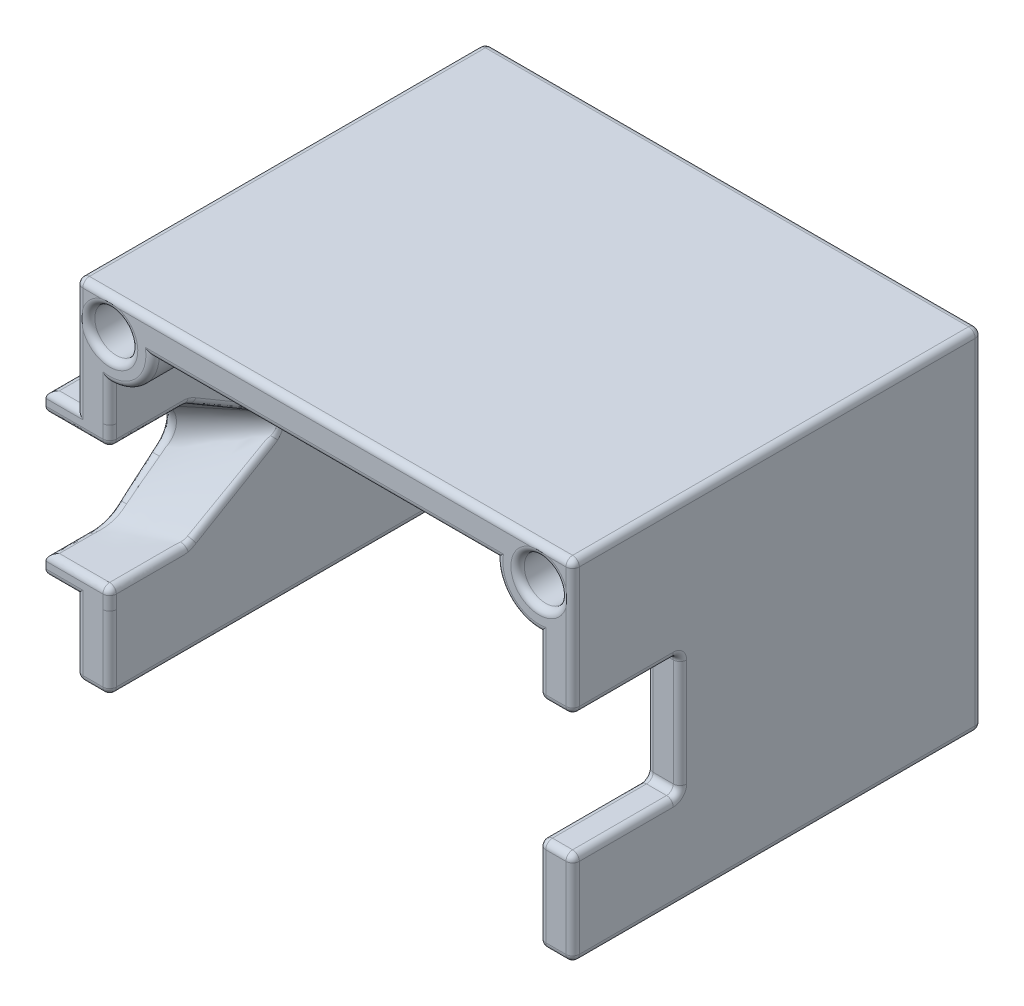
SolidWorks part; units mm, degrees
ref_plane "Front Plane" through (0, 0, 0) normal (0, 0, 1) x (1, 0, 0)
ref_plane "Top Plane" through (0, 0, 0) normal (0, 1, 0) x (1, 0, 0)
ref_plane "Right Plane" through (0, 0, 0) normal (1, 0, 0) x (0, 0, -1)
sketch "Sketch1" plane through (0, 0, 0) normal (0, 1, 0) x (1, 0, 0)
  line L1 (-14.6844, 12.1047) -> (14.6844, 12.1047)
  line L2 (-14.6844, 12.1047) -> (-14.6844, -12.1047)
  line L3 (-14.6844, -12.1047) -> (14.6844, -12.1047)
  line L4 (14.6844, 12.1047) -> (14.6844, -12.1047)
  line L5 (-14.6844, 12.1047) -> (14.6844, -12.1047) construction
  line L6 (-14.6844, -12.1047) -> (14.6844, 12.1047) construction
  point P0 (0, 0)
  dimension "D1" = 29.3687
  dimension "D2" = 24.2094
extrude "Boss-Extrude1" add sketch "Sketch1" along normal blind 20.6375
sketch "Sketch2" plane through (0, 0, 0) normal (0, -1, 0) x (1, 0, 0)
  line L0 (14.6844, 12.1047) -> (14.6844, -12.1047) construction
  line L2 (-8.9957, -10.1203) -> (12.7, -10.1203)
  line L3 (12.7, -10.1203) -> (12.7, 9.7234)
  line L4 (12.7, 9.7234) -> (-12.7, 9.7234)
  line L5 (-12.7, 9.7234) -> (-12.7, -10.1203)
  line L6 (-12.7, -10.1203) -> (-8.9957, -10.1203)
  line L7 (-14.6844, 12.1047) -> (14.6844, 12.1047) construction
  line L8 (14.6844, -12.1047) -> (-14.6844, -12.1047) construction
  line L9 (-14.6844, -12.1047) -> (-14.6844, 12.1047) construction
  dimension "D1" = 1.9844
  dimension "D2" = 2.3813
  dimension "D3" = 1.9844
  dimension "D4" = 1.9844
extrude "Cut-Extrude1" cut sketch "Sketch2" against normal offset from surface (18.6531 mm away) 1.9844
sketch "Sketch4" plane through (0, 0, 9.7234) normal (0, 0, -1) x (-1, 0, 0)
  line L0 (-12.7, 0) -> (-12.7, 18.6531)
  line L1 (-12.7, 18.6531) -> (12.7, 18.6531)
  line L2 (12.7, 18.6531) -> (12.7, 0)
  line L3 (12.7, 0) -> (-12.7, 0)
extrude "Cut-Extrude2" cut sketch "Sketch4" against normal through all
sketch "Sketch6" plane through (0, 0, 0) normal (0, -1, 0) x (1, 0, 0)
  line L0 (12.7, -10.1203) -> (12.7, 12.1047) construction
  line L1 (-12.7, -10.1203) -> (12.7, -10.1203) construction
  line L2 (12.7, -7.5803) -> (12.7, -10.1203)
  line L3 (12.7, -10.1203) -> (10.16, -10.1203)
  line L4 (0, -12.1047) -> (0, -10.1203) construction
  line L5 (14.6844, -12.1047) -> (-14.6844, -12.1047) construction
  arc A0 (12.7, -7.5803) -> (10.16, -10.1203) centre (12.7, -10.1203) ccw
  dimension "D1" = 2.54
ref_plane "Plane1" through (0, 0, 0) normal (1, 0, 0) x (0, 0, 1)
extrude "Boss-Extrude2" add sketch "Sketch6" against normal up to next
sketch "Sketch8" plane through (0, 0, 0) normal (0, -1, 0) x (1, 0, 0)
  line L0 (14.6844, -12.1047) -> (10.9039, -8.3243) construction
  arc A0 (12.7, -7.5803) -> (10.16, -10.1203) centre (12.7, -10.1203) ccw construction
  circle A1 centre (12.7, -10.1203) radius 1.27
  dimension "D2" = 2.54
extrude "Cut-Extrude3" cut sketch "Sketch8" against normal blind 2.032 contours A1
mirror "Mirror1" about plane through (0, 0, 0) normal (1, 0, 0) of "Cut-Extrude3", "Boss-Extrude2"
sketch "Sketch7" plane through (0, 0, 12.1047) normal (0, 0, 1) x (1, 0, 0)
  line L0 (12.7, 18.6531) -> (12.7, 0) construction
  line L1 (-12.7, 18.6531) -> (12.7, 18.6531) construction
  line L2 (10.16, 18.6531) -> (12.7, 18.6531)
  line L3 (12.7, 18.6531) -> (12.7, 16.1131)
  arc A0 (12.7, 16.1131) -> (10.16, 18.6531) centre (12.7, 18.6531) cw
  dimension "D1" = 2.54
extrude "Boss-Extrude3" add sketch "Sketch7" against normal up to surface (22.225 mm away)
sketch "Sketch9" plane through (0, 0, 12.1047) normal (0, 0, 1) x (1, 0, 0)
  line L0 (10.9039, 16.8571) -> (14.6844, 20.6375) construction
  arc A0 (10.16, 18.6531) -> (12.7, 16.1131) centre (12.7, 18.6531) ccw construction
  circle A1 centre (12.7, 18.6531) radius 1.27
  dimension "D2" = 2.54
extrude "Cut-Extrude4" cut sketch "Sketch9" against normal blind 2.032
mirror "Mirror2" about plane through (0, 0, 0) normal (1, 0, 0) of "Cut-Extrude4", "Boss-Extrude3"
sketch "Sketch10" plane through (-14.6844, 0, 0) normal (-1, 0, 0) x (0, 0, 1)
  line L1 (5.7547, 5.5556) -> (12.1047, 5.5556)
  line L2 (5.7547, 5.5556) -> (5.7547, 12.6994)
  line L3 (5.7547, 12.6994) -> (12.1047, 12.6994)
  line L4 (12.1047, 5.5556) -> (12.1047, 12.6994)
  line L5 (12.1047, 20.6375) -> (12.1047, 0) construction
  line L6 (-12.1047, 9.1275) -> (12.1047, 9.1275) construction
  line L7 (-12.1047, 20.6375) -> (-12.1047, 0) construction
  dimension "D1" = 3.5719
  dimension "D2" = 6.35
extrude "Cut-Extrude5" cut sketch "Sketch10" against normal through all
fillet "Fillet1" radius 0.3969 51 edges at (14.6844, 12.6994, 8.9297) (12.7, 12.6994, 8.9297) (14.6844, 16.6684, 12.1047) (13.6922, 12.6994, 12.1047) (12.7, 14.4062, 12.1047) (10.9039, 16.8571, 12.1047) (13.97, 18.6531, 12.1047) (0, 18.6531, 12.1047) (-13.97, 18.6531, 12.1047) (-10.9039, 16.8571, 12.1047) (-12.7, 14.4062, 12.1047) (-13.6922, 12.6994, 12.1047) (-12.7, 9.1275, 5.7547) (-13.6922, 12.6994, 5.7547) (13.6922, 12.6994, 5.7547) (14.6844, 9.1275, 5.7547) (12.7, 9.1275, 5.7547) (14.6844, 0, 0) (12.7, 0, 2.2622) (10.9039, 0, -8.3243) (-10.9039, 0, -8.3243) (0, 0, -10.1203) (0, 0, -12.1047) (14.6844, 10.3187, -12.1047) (0, 20.6375, -12.1047) (14.6844, 20.6375, 0) (0, 20.6375, 12.1047) (-14.6844, 16.6684, 12.1047) (-14.6844, 20.6375, 0) (-12.7, 12.6994, 8.9297) (-14.6844, 12.6994, 8.9297) (-14.6844, 9.1275, 5.7547) (-12.7, 0, 2.2622) (-14.6844, 0, 0) (-14.6844, 10.3187, -12.1047) (-12.7, 0, -11.3903) (12.7, 0, -11.3903) (-12.7, 5.5556, 8.9297) (-14.6844, 5.5556, 8.9297) (14.6844, 5.5556, 8.9297) (12.7, 5.5556, 8.9297) (-14.6844, 2.7778, 12.1047) (-12.7, 2.7778, 12.1047) (-13.6922, 5.5556, 5.7547) (-13.6922, 0, 12.1047) (13.6922, 0, 12.1047) (12.7, 2.7778, 12.1047) (14.6844, 2.7778, 12.1047) (13.6922, 5.5556, 5.7547) (13.6922, 5.5556, 12.1047) (-13.6922, 5.5556, 12.1047)
sketch "Sketch11" plane through (0, 0, -12.1047) normal (0, 0, -1) x (-1, 0, 0)
  line L0 (5.28, 14.7066) -> (-4.245, 14.7066)
  line L1 (-4.245, 14.7066) -> (-4.245, 0)
  line L2 (-4.245, 0) -> (5.28, 0)
  line L3 (5.28, 0) -> (5.28, 14.7066)
  line L6 (14.2875, 0) -> (13.2082, 0) construction
  line L7 (5.28, 14.2875) -> (5.28, 0.3969) construction
  line L8 (-4.245, 0) -> (-4.245, 14.2875) construction
  dimension "D1" = 14.7066
extrude "Cut-Extrude6" cut sketch "Sketch11" against normal through all contours L0 L1 L2 L3
fillet "Fillet2" radius 0.3969 12 edges at (4.245, 0.1162, -10.2366) (-5.28, 0.1162, -10.2366) (-0.5175, 14.7066, -10.1203) (-5.28, 0.1162, -11.9884) (-5.28, 7.5517, -10.1203) (-5.28, 0, -11.1125) (4.245, 0.1162, -11.9884) (4.245, 7.5517, -10.1203) (4.245, 0, -11.1125) (-5.28, 7.5517, -12.1047) (-0.5175, 14.7066, -12.1047) (4.245, 7.5517, -12.1047)
sketch "Sketch15" plane through (-14.6844, 0, 0) normal (-1, 0, 0) x (0, 0, 1)
  line L0 (-12.1047, 4.365) -> (12.1047, 4.365) construction
  line L2 (-12.1047, 13.89) -> (12.1047, 13.89) construction
  line L4 (-12.1047, 0.3969) -> (-12.1047, 20.2406) construction
  line L5 (12.1047, 18.1449) -> (12.1047, 13.0962) construction
  line L6 (12.1047, 5.1587) -> (12.1047, 0.3969) construction
  line L7 (6.1516, 5.5556) -> (11.7078, 5.5556) construction
  line L8 (11.7078, 12.6994) -> (6.1516, 12.6994) construction
  dimension "D1" = 1.1906
  dimension "D2" = 1.1906
sketch "Sketch12" plane through (-14.6844, 0, 0) normal (-1, 0, 0) x (0, 0, 1)
  line L1 (1.3891, 4.365) -> (12.1047, 4.365)
  line L2 (1.3891, 4.365) -> (1.3891, 13.89)
  line L3 (1.3891, 13.89) -> (12.1047, 13.89)
  line L4 (12.1047, 4.365) -> (12.1047, 13.89)
  line L5 (12.1047, 18.1449) -> (12.1047, 13.0962) construction
  line L6 (6.1516, 5.5556) -> (11.7078, 5.5556) construction
  line L7 (11.7078, 12.6994) -> (6.1516, 12.6994) construction
  line L8 (5.3578, 5.9525) -> (5.3578, 12.3025) construction
  dimension "D1" = 1.1906
  dimension "D2" = 1.1906
  dimension "D3" = 3.9688
  dimension "D4" = 0
extrude "Boss-Extrude4" add sketch "Sketch12" along normal blind 1.778 and the other way up to surface
sketch "Sketch14" plane through (-16.4624, 0, 0) normal (-1, 0, 0) x (0, 0, 1)
  line L0 (1.3891, 9.1275) -> (12.1047, 9.1275) construction
  line L1 (1.3891, 13.89) -> (1.3891, 4.365) construction
  line L2 (12.1047, 4.365) -> (12.1047, 13.89) construction
  line L3 (7.9274, 11.9554) -> (6.222, 10.25)
  line L4 (9.7234, 5.5556) -> (12.1047, 5.5556)
  line L5 (6.222, 8.005) -> (7.9274, 6.2996)
  line L6 (9.7234, 12.6994) -> (12.1047, 12.6994)
  line L7 (12.1047, 13.89) -> (1.3891, 13.89) construction
  line L8 (12.1047, 5.5556) -> (12.1047, 12.6994)
  arc A0 (6.222, 10.25) -> (6.222, 8.005) centre (7.3445, 9.1275) ccw
  arc A1 (7.9274, 11.9554) -> (9.7234, 12.6994) centre (9.7234, 10.1594) cw
  arc A2 (7.9274, 6.2996) -> (9.7234, 5.5556) centre (9.7234, 8.0956) ccw
  dimension "D2" = 1.5875
  dimension "D3" = 2.54
  dimension "D1" = 1.1906
  dimension "D4" = 2.3813
  dimension "D5" = 45
sketch "Sketch13" plane through (-12.7, 0, 0) normal (1, 0, 0) x (0, 0, -1)
  line L0 (-7.158, 5.662) -> (-2.3461, 8.4401)
  line L1 (-12.1047, 13.89) -> (-12.1047, 4.365) construction
  line L2 (-12.1047, 5.5556) -> (-7.5549, 5.5556)
  line L3 (-2.3461, 9.8149) -> (-7.158, 12.593)
  line L4 (-12.1047, 9.1275) -> (7.5803, 9.1275) construction
  line L5 (-1.3891, 9.1275) -> (-12.1047, 9.1275) construction
  line L6 (7.5803, 16.1131) -> (7.5803, 0.3969) construction
  line L7 (-12.1047, 12.6994) -> (-7.5549, 12.6994)
  line L8 (-12.1047, 13.89) -> (-12.1047, 4.365) construction
  line L9 (-12.1047, 12.6994) -> (-12.1047, 5.5556)
  arc A0 (-2.3461, 8.4401) -> (-2.3461, 9.8149) centre (-2.743, 9.1275) ccw
  arc A1 (-7.158, 5.662) -> (-7.5549, 5.5556) centre (-7.5549, 6.3494) cw
  arc A2 (-7.158, 12.593) -> (-7.5549, 12.6994) centre (-7.5549, 11.9056) ccw
  point P18 (-7.3422, 5.5556)
  dimension "D2" = 0.7937
  dimension "D3" = 0.7937
  dimension "D1" = 60
  dimension "D4" = 4.7625
  dimension "D5" = 1.1906
loft "Cut-Loft1" cut profiles "Sketch13", "Sketch14"
fillet "Fillet4" radius 0.3969 29 edges at (-15.5734, 4.365, 1.3891) (-15.5734, 13.89, 1.3891) (-14.5681, 13.89, 11.9884) (-14.5681, 4.365, 11.9884) (-15.3749, 4.365, 12.1047) (-15.3749, 13.89, 12.1047) (-16.4624, 9.1275, 1.3891) (-16.4624, 4.365, 6.7469) (-16.4624, 13.89, 6.7469)
fillet "Fillet5" radius 0.3969 4 edges at (-12.7511, 12.9014, 12.0536) (-12.7511, 5.3536, 12.0536)
equation "\"D2@Sketch1\"=0.75in+2/8in-1/16+1/64"
equation "\"D1@Sketch1\"=1in+10/64in"
equation "\"D1@Sketch10\"=0.1875in-3/64in"
equation "\"D1@Boss-Extrude4\"=0.20in-0.13in"
